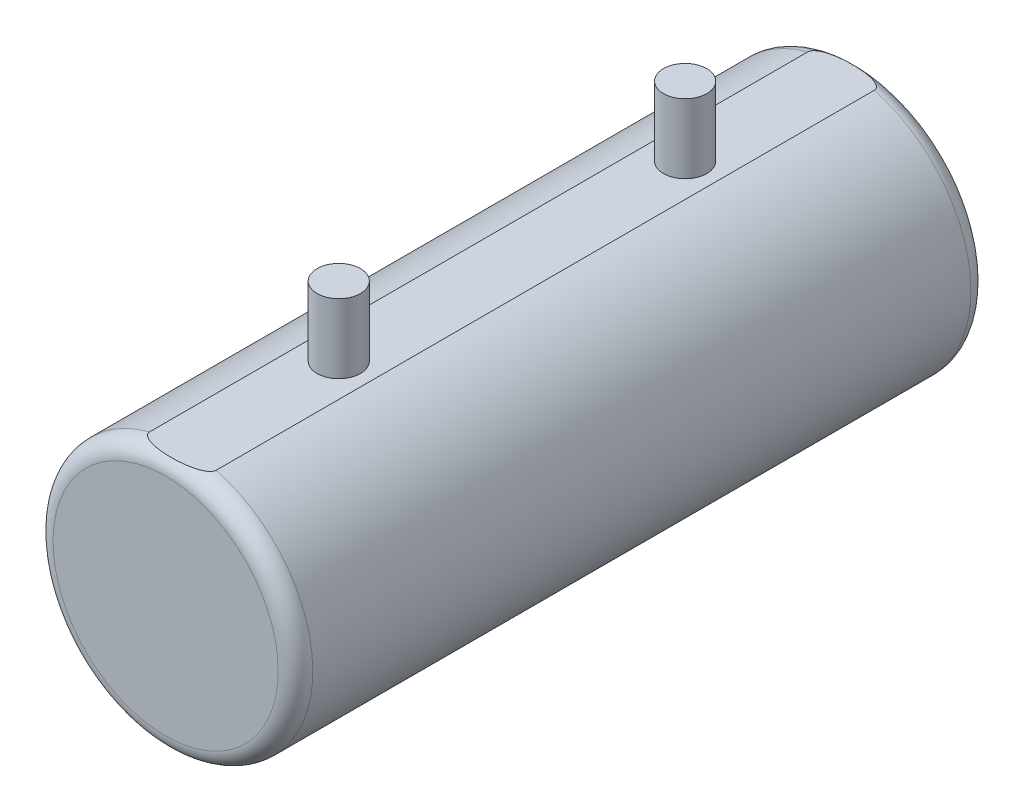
SolidWorks part; units mm, degrees
ref_plane "Plan de face" through (0, 0, 0) normal (0, 0, 1) x (1, 0, 0)
ref_plane "Plan de dessus" through (0, 0, 0) normal (0, 1, 0) x (1, 0, 0)
ref_plane "Plan de droite" through (0, 0, 0) normal (1, 0, 0) x (0, 0, -1)
sketch "Esquisse1" plane through (0, 0, 0) normal (0, 0, 1) x (1, 0, 0)
  circle A0 centre (0, 0) radius 15
  dimension "D1" = 30
extrude "Boss.-Extru.1" add sketch "Esquisse1" along normal mid plane 80
sketch "Esquisse2" plane through (0, 0, 40) normal (0, 0, 1) x (1, 0, 0)
  line L1 (-7.3456, 16.0146) -> (7.2698, 16.0146)
  line L2 (-7.3456, 16.0146) -> (-7.3456, 14.5)
  line L3 (-7.3456, 14.5) -> (7.2698, 14.5)
  line L4 (7.2698, 16.0146) -> (7.2698, 14.5)
  dimension "D1" = 14.5
extrude "Enlèv. mat.-Extru.1" cut sketch "Esquisse2" against normal through all
fillet "Congé1" radius 2 2 edges at (0, -15, -40) (0, -15, 40)
sketch "Esquisse3" plane through (0, 14.5, 0) normal (0, 1, 0) x (1, 0, 0)
  circle A0 centre (0, 20) radius 2.5
  circle A1 centre (0, -20) radius 2.5
  dimension "D1" = 5
  dimension "D2" = 40
  dimension "D3" = 20
extrude "Boss.-Extru.2" add sketch "Esquisse3" along normal blind 8
